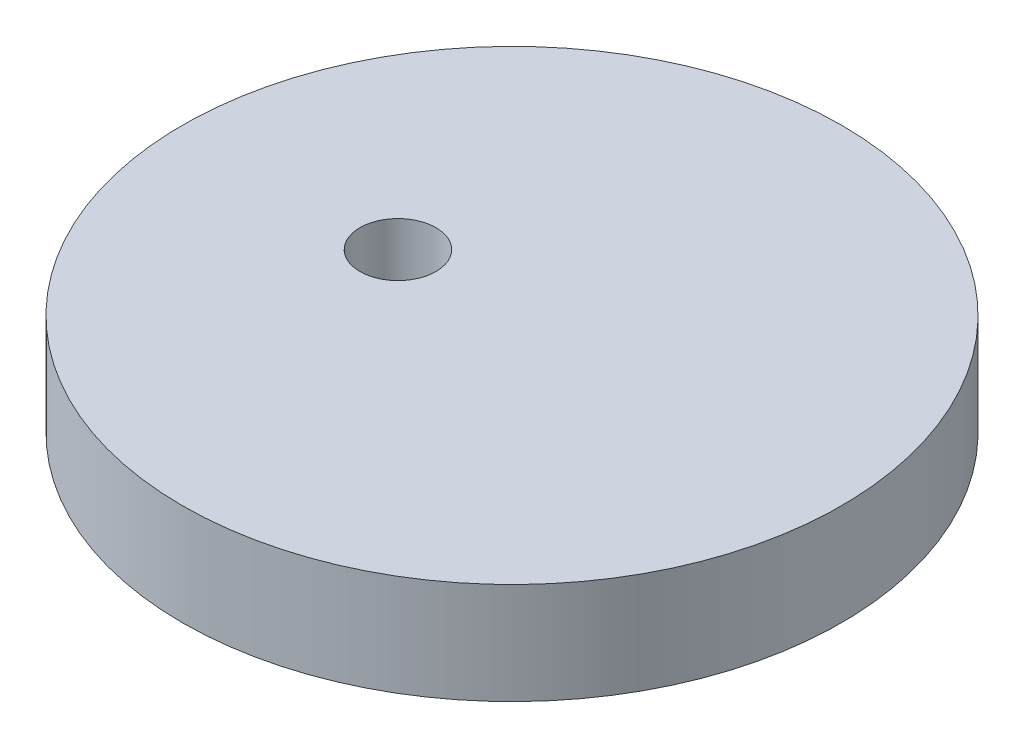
SolidWorks part; units mm, degrees
ref_plane "Ebene vorne" through (0, 0, 0) normal (0, 0, 1) x (1, 0, 0)
ref_plane "Ebene oben" through (0, 0, 0) normal (0, 1, 0) x (1, 0, 0)
ref_plane "Ebene rechts" through (0, 0, 0) normal (1, 0, 0) x (0, 0, -1)
sketch "Skizze1" plane through (0, 0, 0) normal (0, 1, 0) x (1, 0, 0)
  line L0 (0, 35.4563) -> (0, -32.854) construction
  line L1 (-40.4982, 0) -> (35.9442, 0) construction
  circle A0 centre (0, 0) radius 13
  circle A1 centre (-4.5, 0) radius 4 construction
  circle A2 centre (-4.5, 0) radius 8 construction
  circle A3 centre (-4.5, 0) radius 1.5
  dimension "D1" = 26
  dimension "D2" = 8
  dimension "D4" = 16
  dimension "D5" = 3
  dimension "D3" = 4.5
extrude "Aufsatz-Linear austragen1" add sketch "Skizze1" along normal blind 4
